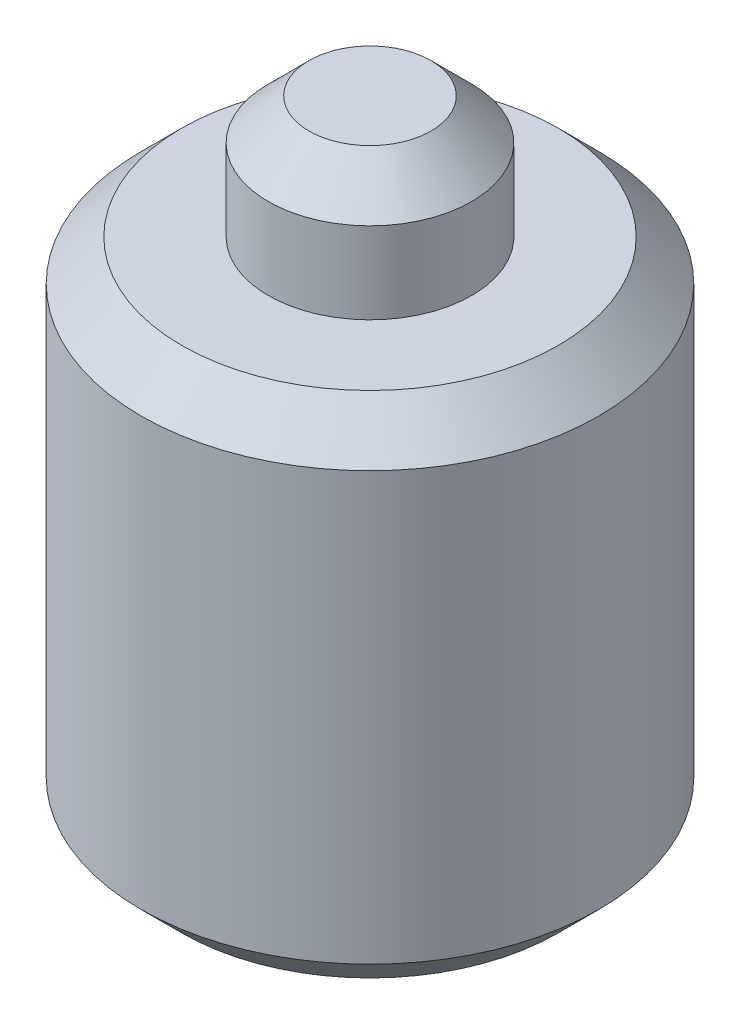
SolidWorks part; units mm, degrees
ref_plane "Front Plane" through (0, 0, 0) normal (0, 0, 1) x (1, 0, 0)
ref_plane "Top Plane" through (0, 0, 0) normal (0, 1, 0) x (1, 0, 0)
ref_plane "Right Plane" through (0, 0, 0) normal (1, 0, 0) x (0, 0, -1)
sketch "Sketch1" plane through (0, 0, 0) normal (0, 0, 1) x (1, 0, 0)
  line L0 (0, 0) -> (0, 7.9804) construction
  line L1 (0, 0) -> (-2.3495, 0)
  line L2 (-2.8575, 0.508) -> (-2.8575, 5.842)
  line L3 (-2.3495, 6.35) -> (-1.27, 6.35)
  line L4 (-1.27, 6.35) -> (-1.27, 7.366)
  line L5 (-0.762, 7.874) -> (0, 7.874)
  line L6 (0, 7.874) -> (0, 0)
  line L7 (-1.27, 7.366) -> (-0.762, 7.874)
  line L8 (-2.8575, 5.842) -> (-2.3495, 6.35)
  line L9 (-2.3495, 0) -> (-2.8575, 0.508)
  point P4 (-2.8575, 0)
  point P5 (-2.8575, 6.35)
  point P7 (-1.27, 7.874)
  dimension "D1" = 2.54
  dimension "D2" = 1.524
  dimension "D3" = 5.715
  dimension "D4" = 6.35
revolve "Revolve1" add sketch "Sketch1" angle 360 about L0
